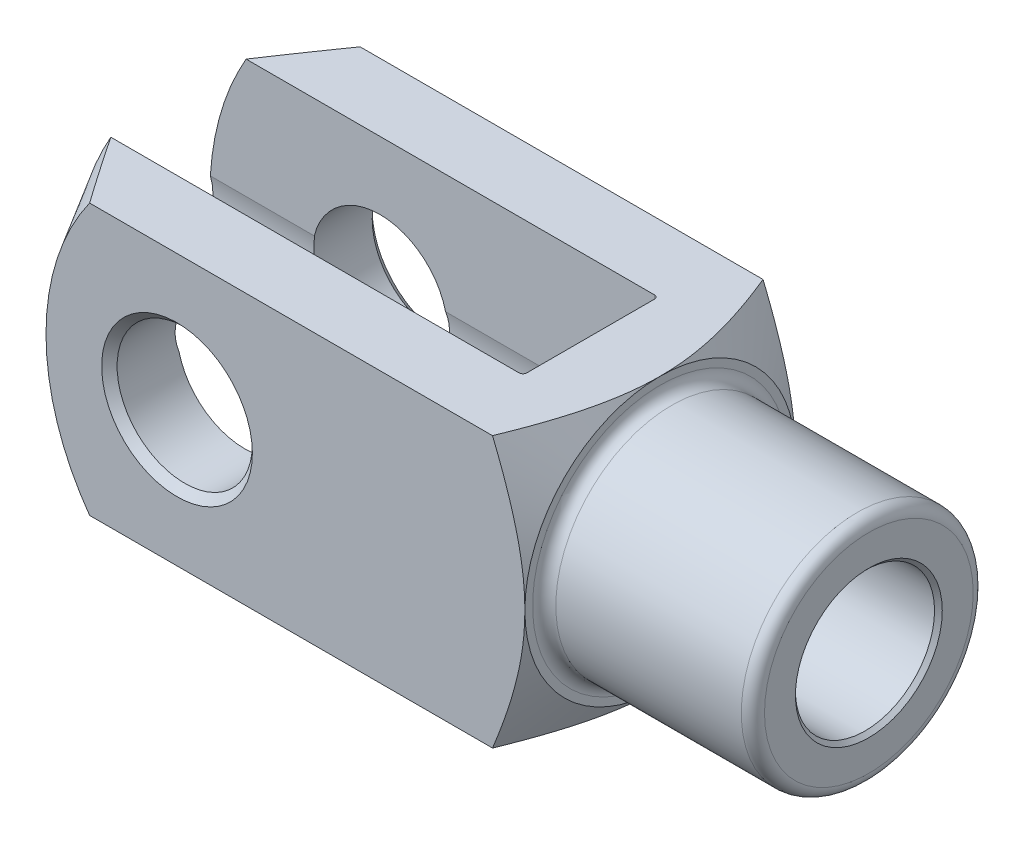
SolidWorks part; units mm, degrees
ref_plane "Front Plane" through (0, 0, 0) normal (0, 0, 1) x (1, 0, 0)
ref_plane "Top Plane" through (0, 0, 0) normal (0, 1, 0) x (1, 0, 0)
ref_plane "Right Plane" through (0, 0, 0) normal (1, 0, 0) x (0, 0, -1)
sketch "Sketch1" plane through (0, 0, 0) normal (1, 0, 0) x (0, 0, -1)
  line L0 (0, 0) -> (0, 50000) construction
  line L1 (0, 0) -> (50000, 0) construction
  line L2 (-35, -35) -> (-35, 35)
  line L3 (-35, 35) -> (35, 35)
  line L4 (35, -35) -> (35, 35)
  line L5 (-35, -35) -> (35, -35)
  point P9 (0, 35)
  point P11 (35, 0)
  point P12 (-35, 0)
  dimension "D1" = 70
  dimension "D2" = 70
extrude "Extrude1" add sketch "Sketch1" against normal blind 188
sketch "Sketch2" plane through (0, 0, 0) normal (1, 0, 0) x (0, 0, -1)
  circle A0 centre (0, 0) radius 30
  circle A1 centre (0, 0) radius 60
  dimension "D1" = 60
  dimension "D2" = 120
extrude "Extrude2" cut sketch "Sketch2" against normal blind 54
sketch "Sketch3" plane through (0, 0, 35) normal (0, 0, 1) x (1, 0, 0)
  circle A0 centre (-144, 0) radius 17.5
  dimension "D1" = 35
  dimension "D2" = 144
extrude "Extrude3" cut sketch "Sketch3" against normal through all
sketch "Sketch4" plane through (0, 35, 0) normal (0, 1, 0) x (1, 0, 0)
  line L0 (0, 0) -> (-50000, 0) construction
  line L1 (-188, -17.5) -> (-188, 17.5)
  line L2 (-188, 35) -> (-188, -35) construction
  line L3 (-188, 17.5) -> (-72, 17.5)
  line L4 (-72, 17.5) -> (-72, -17.5)
  line L5 (-144, 35) -> (-144, -35) construction
  line L6 (-188, -17.5) -> (-72, -17.5)
  point P7 (-144, 0)
  point P13 (-72, 0)
  point P14 (-188, 0)
  dimension "D1" = 72
  dimension "D2" = 35
extrude "Extrude4" cut sketch "Sketch4" against normal through all
fillet "Fillet1" radius 1 2 edges at (-72, 0, 17.5) (-72, 0, -17.5)
fillet "Fillet2" radius 3 2 edges at (0, 0, -30) (-54, 0, -30)
chamfer "Chamfer2" distance 2 angle 45 2 edges at (-126.5, 0, -35) (-126.5, 0, 35)
sketch "Sketch6" plane through (0, 0, 0) normal (0, 0, 1) x (1, 0, 0)
  line L0 (-54, -35) -> (-54, -70)
  line L1 (-54, -70) -> (-74.2073, -70)
  line L2 (-74.2073, -70) -> (-54, -35)
  dimension "D1" = 30
  dimension "D2" = 70
revolve "Cut-Revolve1" cut sketch "Sketch6" angle 360 about axis through (-54, 0, 0) along (1, 0, 0)
sketch "Sketch7" plane through (0, 0, 0) normal (0, 1, 0) x (1, 0, 0)
  line L0 (-177.8964, -35) -> (-188, -17.5)
  line L1 (-188, 17.5) -> (-177.8964, 35)
  line L2 (-177.8964, 35) -> (-258, 35)
  line L3 (-188, 17.5) -> (-188, -17.5)
  line L4 (-258, 35) -> (-258, -35)
  line L5 (-258, -35) -> (-177.8964, -35)
  line L6 (-188, 35) -> (-62.3701, 35) construction
  line L7 (-188, -35) -> (-62.3701, -35) construction
  line L8 (-118, 0.6162) -> (-118, 50000.6162) construction
  dimension "D1" = 120
  dimension "D2" = 70
  dimension "D3" = 70
revolve "Cut-Revolve2" cut sketch "Sketch7" angle 180 about L8
sketch "Sketch8" plane through (0, 0, 0) normal (1, 0, 0) x (0, 0, -1)
  circle A0 centre (0, 0) radius 18
  dimension "D1" = 36
extrude "Extrude5" cut sketch "Sketch8" against normal through all
chamfer "Chamfer3" distance 1 angle 45 1 edges at (0, 0, -18)
equation "\"D2@Sketch1\" = \"D1@Sketch1\""
equation "\"D2@Sketch2\" = \"D1@Sketch2\"*2"
equation "\"D2@Sketch6\" = \"D1@Sketch1\""
equation "\"D2@Sketch7\" = \"D1@Sketch1\""
equation "\"D3@Sketch7\" = \"D1@Sketch1\""
